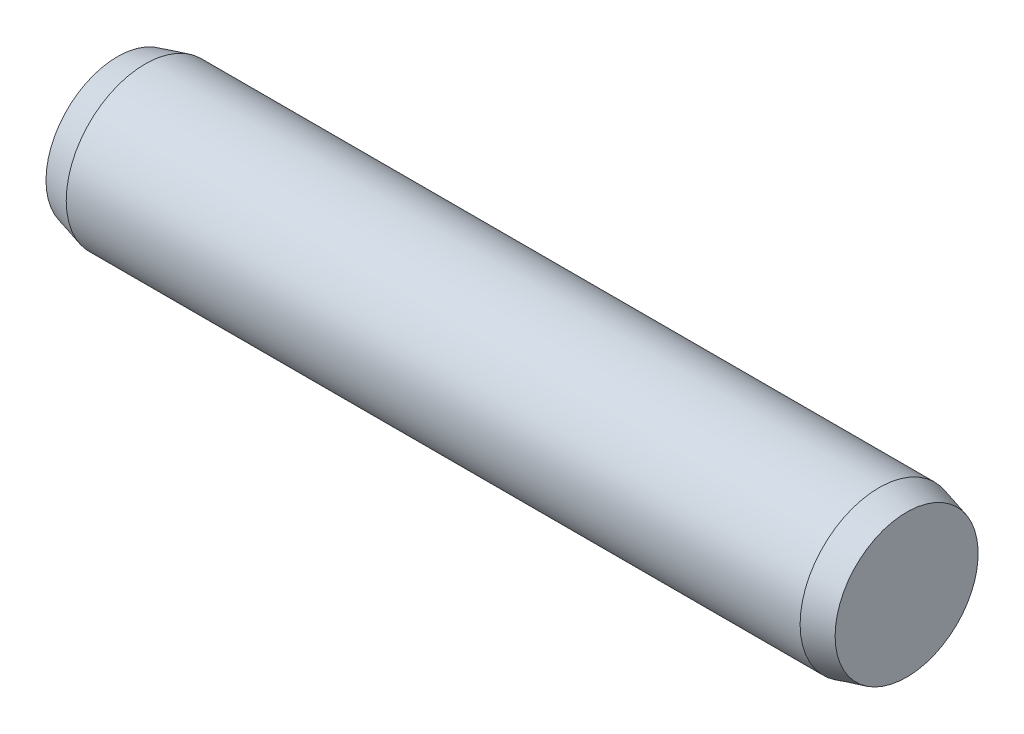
SolidWorks part; units mm, degrees
ref_plane "Plane1" through (0, 0, 0) normal (0, 0, 1) x (1, 0, 0)
ref_plane "Plane2" through (0, 0, 0) normal (0, 1, 0) x (1, 0, 0)
ref_plane "Plane3" through (0, 0, 0) normal (1, 0, 0) x (0, 0, -1)
revolve "Base-Revolve" add sketch "Sketch1" angle 360 about L1
sketch "Sketch1" plane through (0, 0, 0) normal (0, 0, 1) x (1, 0, 0)
  line L1 (-6.35, 0) -> (107.95, 0) construction
  line L2 (0, 0) -> (10, 0)
  line L3 (10, 0) -> (10, 0.9062)
  line L4 (10, 0.9062) -> (9.65, 1)
  line L5 (9.65, 1) -> (0.35, 1)
  line L6 (0, 0.9062) -> (0, 0)
  line L7 (0, 0.9062) -> (0.35, 1)
  dimension "D1" = 0.35
  dimension "D2" = 15
  dimension "D3" = 15
  dimension "Diameter" = 2
  dimension "Length" = 10
  dimension "Chamfer_len" = 0.35
equation "\"D3@Sketch1\" = 15.0"
equation "\"D1@Sketch1\" = \"Chamfer_len@Sketch1\""
equation "\"D2@Sketch1\" = \"D3@Sketch1\""
